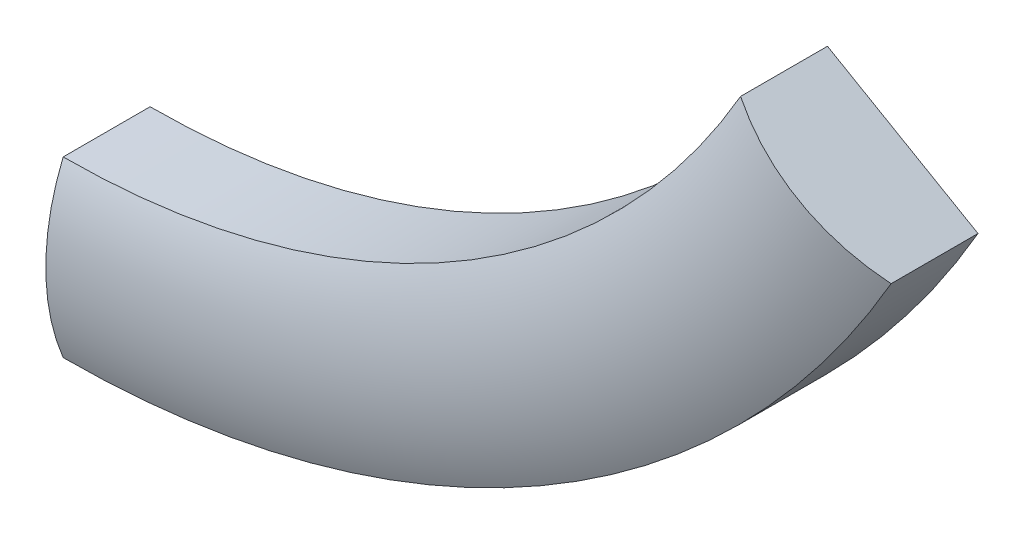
SolidWorks part; units mm, degrees
ref_plane "Vorne" through (0, 0, 0) normal (0, 0, 1) x (1, 0, 0)
ref_plane "Oben" through (0, 0, 0) normal (0, 1, 0) x (1, 0, 0)
ref_plane "Rechts" through (0, 0, 0) normal (1, 0, 0) x (0, 0, -1)
sketch "Skizze1" plane through (0, 0, 0) normal (0, 0, 1) x (1, 0, 0)
  line L0 (-433.0127, -250) -> (-866.0254, -500) construction
  line L2 (-866.0254, -500) -> (-952.6279, -550) construction
  line L3 (-866.0254, -500) -> (-876.0254, -500)
  arc A0 (-433.0127, -250) -> (-866.0254, -500) centre (-866.0254, 0) cw
  arc A1 (-866.0254, -440) -> (-484.9742, -220) centre (-866.0254, 0) ccw construction
  dimension "D1" = 500
  dimension "D2" = 60
  dimension "D3" = 100
  dimension "D4" = 10
ref_plane "Ebene1" through (-433.0127, -250, 0) normal (-0.5, -0.866, 0) x (0.866, -0.5, 0)
sketch "Skizze2" plane through (-433.0127, -250, 0) normal (-0.5, -0.866, 0) x (0.866, -0.5, 0)
  line L2 (50, 50) -> (50, 0)
  line L3 (50, 0) -> (-50, 0)
  line L4 (-50, 50) -> (-50, 0)
  arc A0 (50, 50) -> (-50, 50) centre (0, -70) ccw
  dimension "D1" = 100
  dimension "D2" = 50
  dimension "D3" = 60
sweep "Austragung1" add profiles "Skizze2" path "Skizze1"
sketch "Skizze3" plane through (0, 0, 0) normal (0, 0, -1) x (-1, 0, 0)
  circle A0 centre (448.3683, -263.6005) radius 0.05
  dimension "D1" = 0.1
extrude "Linear austragen1" add sketch "Skizze3" along normal blind 0.1
ref_plane "Ebene2" through (-952.6279, -550, 0) normal (-0.866, -0.5, 0) x (0.5, -0.866, 0)
sketch "Skizze4" plane through (-952.6279, -550, 0) normal (-0.866, -0.5, 0) x (0.5, -0.866, 0)
  line L4 (43.3013, 0) -> (116.9873, 0) construction
  line L5 (-48.3975, 70) -> (116.9873, 70)
  line L6 (-48.3975, 70) -> (-48.3975, 0)
  line L7 (-48.3975, 0) -> (116.9873, 0)
  line L10 (116.9873, 70) -> (116.9873, 0)
  line L11 (-48.3975, 50) -> (-48.3975, 0) construction
  line L12 (116.9873, 0) -> (116.9873, 50) construction
  dimension "D1" = 70
extrude "Schnitt-Linear austragen1" cut sketch "Skizze4" against normal up to surface (32.4574 mm away)
